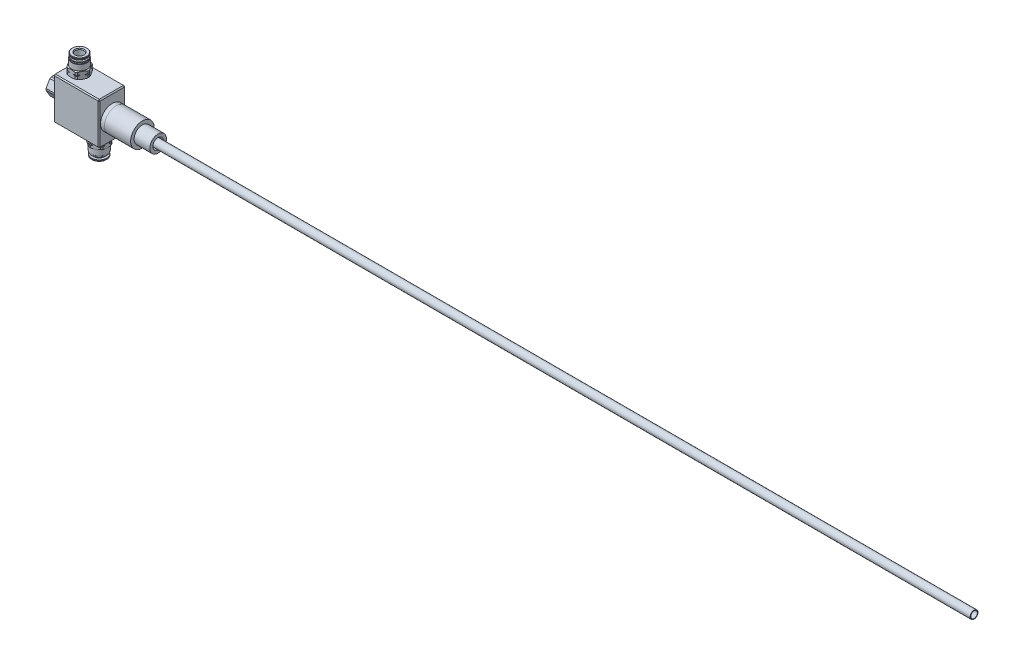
SolidWorks part; units mm, degrees
other "MLFS25-"
other "MLFS25"
ref_plane "Front Plane" through (0, 0, 0) normal (0, 0, 1) x (1, 0, 0)
ref_plane "Top Plane" through (0, 0, 0) normal (0, 1, 0) x (1, 0, 0)
ref_plane "Right Plane" through (0, 0, 0) normal (1, 0, 0) x (0, 0, -1)
sketch "Sketch1" plane through (0, 0, 0) normal (0, 0, 1) x (1, 0, 0)
  line L0 (-71.9924, 0) -> (105.9462, 0) construction
  line L1 (0, 6.35) -> (0, 9.0043)
  line L2 (0, 9.0043) -> (-20, 9.0043)
  line L3 (-20, 9.0043) -> (-20, 9.017)
  line L4 (-20, 9.017) -> (-23, 9.017)
  line L5 (-23, 9.017) -> (-23, 4)
  line L7 (0, 6.35) -> (11.9888, 6.35)
  line L8 (11.9888, 6.35) -> (11.9888, 4)
  line L10 (-23, 4) -> (11.9888, 4)
  dimension "D1" = 23
  dimension "D2" = 18.0086
  dimension "D3" = 18.034
  dimension "D4" = 3
  dimension "D5" = 12.7
  dimension "D6" = 11.9888
  dimension "D7" = 8
revolve "Revolve1" add sketch "Sketch1" angle 360 about L0
sketch "Sketch2" plane through (0, 0, 0) normal (0, 0, 1) x (1, 0, 0)
  line L0 (0, 0) -> (-72.5041, 0) construction
  line L1 (-23, 16.002) -> (-58, 16.002)
  line L2 (-23, 16.002) -> (-23, -16)
  line L3 (-23, -16) -> (-58, -16)
  line L4 (-58, 16.002) -> (-58, -16)
  line L5 (-23, 9.017) -> (-23, -9.017) construction
  dimension "D1" = 16.002
  dimension "D2" = 16
  dimension "D3" = 35
extrude "Boss-Extrude1" add sketch "Sketch2" along normal mid plane 20
sketch "Sketch3" plane through (0, 0, 0) normal (0, 0, 1) x (1, 0, 0)
  line L0 (-58, 6.985) -> (-66.636, 6.985)
  line L1 (-58, 16.002) -> (-58, -16) construction
  line L2 (-66.636, 6.985) -> (-66.636, 0)
  line L3 (-66.636, 0) -> (-58, 0)
  line L4 (-58, 0) -> (-58, 6.985)
  line L5 (-58, 0) -> (-71.1377, 0) construction
  dimension "D1" = 8.636
  dimension "D2" = 13.97
revolve "Revolve2" add sketch "Sketch3" angle 360 about L5
hole_wizard "1/8 NPT Tapped Hole1" positions "Sketch5" profile "Sketch4" size "1/8" standard "ANSI Inch"
sketch "Sketch5" plane through (0, -16, 0) normal (0, -1, 0) x (-1, 0, 0)
  line L0 (23, -10) -> (23, 10) construction
  point P0 (33, 0)
  dimension "D1" = 10
sketch "Sketch4" plane through (-33, -16, 0) normal (1, 0, 0) x (0, 0, -1)
  line L0 (0, 0) -> (0, 14.2175)
  line L1 (4.2164, 11.684) -> (0, 14.2175)
  line L2 (-4.2164, 11.684) -> (0, 14.2175) construction
  line L3 (4.2164, 11.684) -> (4.2164, 6.858)
  line L4 (4.2164, 6.858) -> (4.5374, 6.858)
  line L5 (4.5374, 6.858) -> (4.7427, 0)
  line L6 (-4.5374, 6.858) -> (-4.7427, 0) construction
  line L7 (4.7427, 0) -> (0, 0)
  line L8 (0, -6.35) -> (0, 107.95) construction
  line L11 (-4.2164, 6.858) -> (-4.5374, 6.858) construction
  dimension "Tap Drill Dia." = 8.4328
  dimension "Tap Drill Depth" = 11.684
  dimension "Thread Dia." = 9.4855
  dimension "Thread Angle" = 3.43
  dimension "Thread Depth" = 6.858
  dimension "Drill Angle" = 118
hole_wizard "1/8 NPT Tapped Hole2" positions "Sketch10" profile "Sketch9" size "1/8" standard "ANSI Inch"
sketch "Sketch10" plane through (0, 16.002, 0) normal (0, 1, 0) x (1, 0, 0)
  circle A0 centre (-33, 0) radius 4.2164 construction
  point P0 (-48.0114, 0)
  dimension "D1" = 15.0114
sketch "Sketch9" plane through (-48.0114, 16.002, 0) normal (1, 0, 0) x (0, 0, 1)
  line L0 (0, 0) -> (0, 14.2175)
  line L1 (4.2164, 11.684) -> (0, 14.2175)
  line L2 (-4.2164, 11.684) -> (0, 14.2175) construction
  line L3 (4.2164, 11.684) -> (4.2164, 6.858)
  line L4 (4.2164, 6.858) -> (4.5374, 6.858)
  line L5 (4.5374, 6.858) -> (4.7427, 0)
  line L6 (-4.5374, 6.858) -> (-4.7427, 0) construction
  line L7 (4.7427, 0) -> (0, 0)
  line L8 (0, -6.35) -> (0, 107.95) construction
  line L11 (-4.2164, 6.858) -> (-4.5374, 6.858) construction
  dimension "Tap Drill Dia." = 8.4328
  dimension "Tap Drill Depth" = 11.684
  dimension "Thread Dia." = 9.4855
  dimension "Thread Angle" = 3.43
  dimension "Thread Depth" = 6.858
  dimension "Drill Angle" = 118
chamfer "Chamfer1" distance 0.762 angle 45 12 edges at (-40.5, 16.002, -10) (-58, 0.001, -10) (-40.5, -16, -10) (-23, 0.001, -10) (-40.5, -16, 10) (-58, 0.001, 10) (-40.5, 16.002, 10) (-23, 0.001, 10) (-58, -16, 0) (-58, 16.002, 0) (-23, 16.002, 0) (-23, -16, 0)
sketch "Sketch7" plane through (0, 0, 0) normal (0, 0, 1) x (1, 0, 0)
  line L0 (0, 0) -> (234.4454, 0) construction
  line L1 (-23, 2.9972) -> (635, 2.9972)
  line L3 (635, 2.9972) -> (635, 2.5146)
  line L4 (-23, 15.24) -> (-23, -15.238) construction
  line L5 (-23, 2.5146) -> (-23, 2.9972)
  line L8 (-23, 2.5146) -> (635, 2.5146)
  dimension "D1" = 5.9944
  dimension "D2" = 635
  dimension "D3" = 5.0292
revolve "Revolve4" add sketch "Sketch7" angle 360 about L0
sketch "Sketch8" plane through (-66.636, 0, 0) normal (-1, 0, 0) x (0, 0, 1)
  line L1 (1.8331, -3.175) -> (3.6662, 0)
  line L2 (3.6662, 0) -> (1.8331, 3.175)
  line L3 (1.8331, 3.175) -> (-1.8331, 3.175)
  line L4 (-1.8331, 3.175) -> (-3.6662, 0)
  line L5 (-3.6662, 0) -> (-1.8331, -3.175)
  line L6 (-1.8331, -3.175) -> (1.8331, -3.175)
  circle A0 centre (0, 0) radius 3.175 construction
  dimension "D1" = 6.35
extrude "Cut-Extrude1" cut sketch "Sketch8" against normal blind 6.604
sketch "Sketch11" plane through (-66.636, 0, 0) normal (-1, 0, 0) x (0, 0, 1)
  line L1 (-3.6662, 6.35) -> (-7.3323, 0)
  line L2 (-7.3323, 0) -> (-3.6662, -6.35)
  line L3 (-3.6662, -6.35) -> (3.6662, -6.35)
  line L4 (3.6662, -6.35) -> (7.3323, 0)
  line L5 (7.3323, 0) -> (3.6662, 6.35)
  line L6 (3.6662, 6.35) -> (-3.6662, 6.35)
  circle A0 centre (0, 0) radius 6.35 construction
  dimension "D1" = 12.7
extrude "Cut-Extrude2" cut sketch "Sketch11" against normal up to surface (8.636 mm away) flip side to cut
inserted part "MLFS25"
move or copy body "Body-Move/Copy2" placed by mates yes
other "Distance1" parameters "D1"=0.762
inserted part "MLFS25-"
move or copy body "Body-Move/Copy4" placed by mates yes
other "Distance2" parameters "D1"=0.762
sketch "Sketch12" plane through (0, 0, -10) normal (0, 0, -1) x (-1, 0, 0)
  line L0 (34.1895, -12.6831) -> (34.1895, 3.806) construction
  line L1 (49.4627, 7.2296) -> (49.4627, 24.2743) construction
  text T0 "OUT"
  text T1 "IN"
  point P3 (49.706, 24.2743)
  point P4 (34.1895, -12.6831)
  point P5 (49.4642, 5.954)
  point P8 (49.4627, 7.2296)
extrude "Cut-Extrude3" cut sketch "Sketch12" against normal blind 0.127
